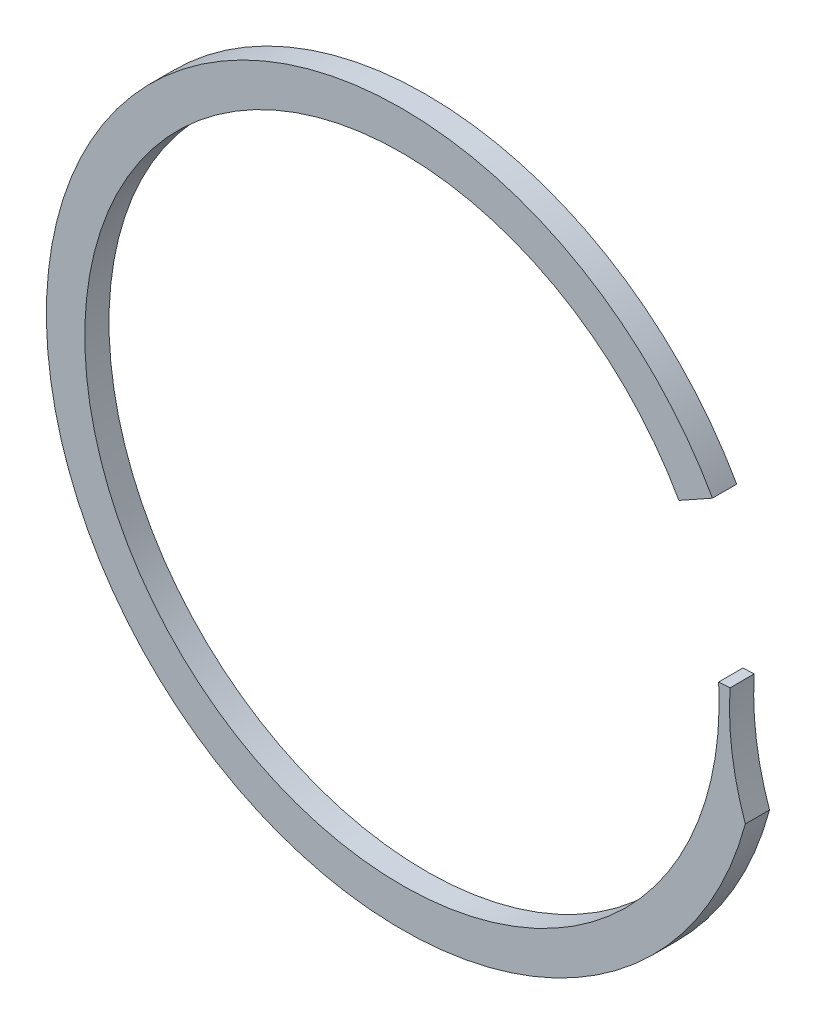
SolidWorks part; units mm, degrees
ref_plane "Front Plane" through (0, 0, 0) normal (0, 0, 1) x (1, 0, 0)
ref_plane "Top Plane" through (0, 0, 0) normal (0, 1, 0) x (1, 0, 0)
ref_plane "Right Plane" through (0, 0, 0) normal (1, 0, 0) x (0, 0, -1)
sketch "Sketch1" plane through (0, 0, 0) normal (0, 0, 1) x (1, 0, 0)
  circle A0 centre (0, 0) radius 10.8204
  dimension "D1" = 21.6408
extrude "Extrude1" add sketch "Sketch1" along normal blind 0.7366
sketch "Sketch2" plane through (0, 0, 0.7366) normal (0, 0, 1) x (1, 0, 0)
  circle A0 centre (0, 0) radius 9.652
  dimension "D1" = 19.304
extrude "Cut-Extrude1" cut sketch "Sketch2" against normal through all
sketch "Sketch3" plane through (0, 0, 0.7366) normal (0, 0, 1) x (1, 0, 0)
  line L0 (0, 0) -> (16.0049, 8.9335)
  line L1 (16.0049, 8.9335) -> (16.7486, 0.9123)
  line L2 (16.7486, 0.9123) -> (0, 0)
extrude "Cut-Extrude2" cut sketch "Sketch3" against normal through all
sketch "Sketch4" plane through (0, 0, 0.7366) normal (0, 0, 1) x (1, 0, 0)
  circle A0 centre (18.4062, 0) radius 8.4401
extrude "Cut-Extrude3" cut sketch "Sketch4" against normal through all
